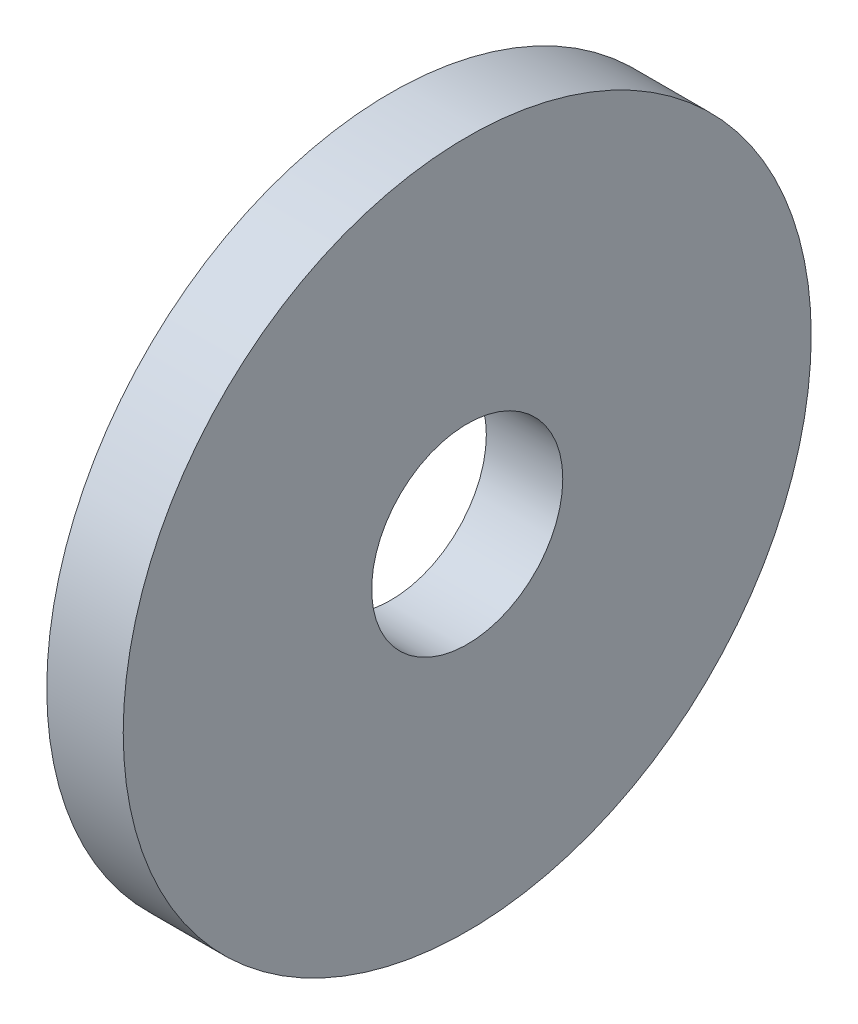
SolidWorks part; units mm, degrees
ref_plane "Plane1" through (0, 0, 0) normal (0, 0, 1) x (1, 0, 0)
ref_plane "Plane2" through (0, 0, 0) normal (0, 1, 0) x (1, 0, 0)
ref_plane "Plane3" through (0, 0, 0) normal (1, 0, 0) x (0, 0, -1)
other "Configuration Table"
sketch "Sketch1" plane through (0, 0, 0) normal (1, 0, 0) x (0, 0, -1)
  circle A0 centre (0, 0) radius 1.25
  circle A1 centre (0, 0) radius 4.5
  dimension "Insid_dia" = 2.5
  dimension "OutsideDia" = 9
extrude "Base-Extrude" add sketch "Sketch1" along normal blind 1
